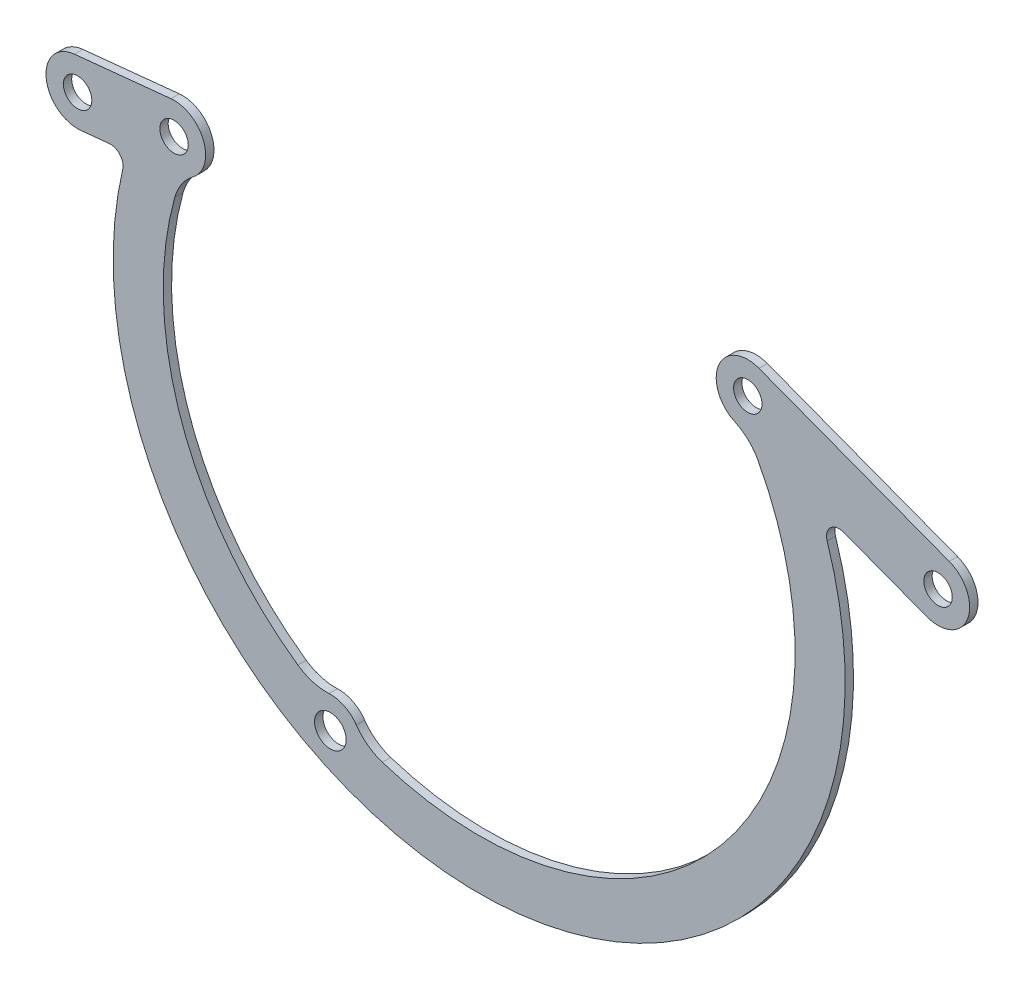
SolidWorks part; units mm, degrees
ref_plane "Front Plane" through (0, 0, 0) normal (0, 0, 1) x (1, 0, 0)
ref_plane "Top Plane" through (0, 0, 0) normal (0, 1, 0) x (1, 0, 0)
ref_plane "Right Plane" through (0, 0, 0) normal (1, 0, 0) x (0, 0, -1)
sketch "Sketch2" plane through (0, 0, 0) normal (0, 0, 1) x (1, 0, 0)
  line L0 (0, 0) -> (-204.25, 0) construction
  line L1 (-204.25, 0) -> (-204.25, -101.25) construction
  line L2 (-204.25, -101.25) -> (-144.25, -101.25) construction
  line L3 (-144.25, -101.25) -> (0, -101.25) construction
  line L4 (0, -101.25) -> (0, 0) construction
  line L5 (0, 0) -> (-144.25, -101.25) construction
  line L6 (-144.25, -101.25) -> (-204.25, 0) construction
  circle A0 centre (0, 0) radius 3.375
  circle A1 centre (-204.25, 0) radius 3.375
  circle A2 centre (-144.25, -101.25) radius 3.375
  dimension "D2" = 6.75
  dimension "D1" = 204.25
  dimension "D3" = 101.25
  dimension "D4" = 60
sketch "Sketch3" plane through (0, 0, 0) normal (0, 0, 1) x (1, 0, 0)
  line L0 (-181.3533, 2.3036) -> (-144.25, -101.25) construction
  line L1 (-144.25, -101.25) -> (-45.1657, 17.1076) construction
  line L2 (-45.1657, 17.1076) -> (-181.3533, 2.3036) construction
  line L4 (-45.1657, 17.1076) -> (-37.4077, -4.5445) construction
  line L5 (-37.4077, -4.5445) -> (-162.8017, -49.4732) construction
  line L6 (0, 0) -> (-144.25, -101.25) construction
  circle A0 centre (-181.3533, 2.3036) radius 3.375
  circle A1 centre (-144.25, -101.25) radius 3.375
  circle A2 centre (-45.1657, 17.1076) radius 3.375
  dimension "D1" = 6.75
  dimension "D2" = 110
  dimension "D3" = 23
  dimension "D4" = 133.2
  dimension "D5" = 15
sketch "Sketch5" plane through (0, 0, 0) normal (0, 0, 1) x (1, 0, 0)
  line L0 (-45.1657, 17.1076) -> (0, 0) construction
  line L3 (-204.25, 0) -> (-181.3533, 2.3036) construction
  line L6 (-205.0008, 7.4623) -> (-182.1041, 9.7659)
  line L7 (-203.4992, -7.4623) -> (-180.6026, -5.1588)
  line L8 (-42.509, 24.1214) -> (2.6566, 7.0137)
  line L9 (-47.8223, 10.0939) -> (-2.6566, -7.0137)
  circle A4 centre (-144.25, -101.25) radius 7.5
  circle A5 centre (-108.925, -30.1692) radius 86.8747
  circle A6 centre (-144.25, -101.25) radius 3.375
  circle A7 centre (0, 0) radius 3.375
  circle A8 centre (-144.25, -101.25) radius 3.375
  circle A9 centre (-45.1657, 17.1076) radius 3.375
  circle A10 centre (-204.25, 0) radius 3.375
  circle A11 centre (-144.25, -101.25) radius 7.5
  circle A12 centre (-45.1657, 17.1076) radius 7.5
  circle A13 centre (-108.925, -30.1692) radius 71.8747
  arc A14 (-205.0008, 7.4623) -> (-203.4992, -7.4623) centre (-204.25, 0) ccw
  arc A15 (-180.6026, -5.1588) -> (-182.1041, 9.7659) centre (-181.3533, 2.3036) ccw
  arc A16 (-42.509, 24.1214) -> (-47.8223, 10.0939) centre (-45.1657, 17.1076) ccw
  arc A17 (-2.6566, -7.0137) -> (2.6566, 7.0137) centre (0, 0) ccw
  circle A18 centre (-181.3533, 2.3036) radius 3.375 construction
  circle A19 centre (-181.3533, 2.3036) radius 3.375
  point P0 (-22.5828, 8.5538)
  point P9 (-192.8017, 1.1518)
  dimension "D2" = 6.75
  dimension "D3" = 15
  dimension "D4" = 15
  dimension "D1" = 15
extrude "Boss-Extrude2" add sketch "Sketch5" along normal blind 1.9812 contours A13 A4 A5 L9 A12 | A4 A11 A6 | A15 L7 A5 A11 A13 | L7 A15 L6 A5 A19 | L6 A14 L7 A5 A10 | A12 A9 | A12 L9 A5 | L9 A17 L8 A5 A7 | A12 A5 L8
fillet "Fillet1" radius 3 2 edges at (-192.4714, -6.3528, 0.9906) (-28.5463, 2.7926, 0.9906)
sketch "Sketch6" plane through (0, 0, 1.9812) normal (0, 0, 1) x (1, 0, 0)
  circle A0 centre (-144.25, -101.25) radius 3.75
  dimension "D1" = 7.5
extrude "Cut-Extrude1" cut sketch "Sketch6" against normal through all
sketch "Sketch7" plane through (0, 0, 1.9812) normal (0, 0, 1) x (1, 0, 0)
  circle A1 centre (-144.25, -101.25) radius 7.5
  circle A6 centre (-181.3533, 2.3036) radius 7.5
  circle A7 centre (-45.1657, 17.1076) radius 7.5
  arc A8 (-174.5097, -0.7647) -> (-182.1041, 9.7659) centre (-181.3533, 2.3036) ccw construction
  circle A9 centre (-108.925, -30.1692) radius 75
  arc A10 (-181.1757, -10.0488) -> (-176.8388, -3.6855) centre (-169.6156, -13.2681) cw
  arc A11 (-151.9575, -91.5956) -> (-144.5663, -93.7567) centre (-145.0723, -81.7673) ccw
  arc A12 (-138.0863, -96.977) -> (-131.9003, -101.5634) centre (-128.2243, -90.1403) ccw
  arc A13 (-48.2879, 10.2884) -> (-42.685, 5.0056) centre (-53.2834, -0.6223) cw
  dimension "D1" = 150
  dimension "D2" = 12
extrude "Cut-Extrude2" cut sketch "Sketch7" against normal through all
equation "\"D1@Boss-Extrude2\"=0.078in"
